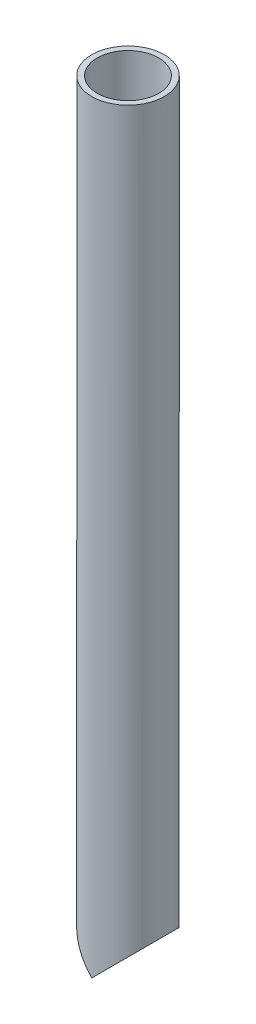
SolidWorks part; units mm, degrees
ref_plane "Front" through (0, 0, 0) normal (0, 0, 1) x (1, 0, 0)
ref_plane "Top" through (0, 0, 0) normal (0, 1, 0) x (1, 0, 0)
ref_plane "Right" through (0, 0, 0) normal (1, 0, 0) x (0, 0, -1)
sketch "Sketch3" plane through (0, 0, 0) normal (0, 1, 0) x (-1, 0, 0)
  circle A0 centre (0, 0) radius 24.13
  circle A1 centre (0, 0) radius 20.447
  dimension "D1" = 48.26
  dimension "D2" = 40.894
extrude "Extrude2" add sketch "Sketch3" along normal blind 508
sketch "Sketch4" plane through (0, 0, -63.5) normal (1, 0, 0) x (0, 0, -1)
  line L0 (-63.5, 508) -> (-63.5, 0) construction
  line L4 (-87.63, 508) -> (-87.63, 0) construction
  circle A0 centre (-63.5, 0) radius 24.13
extrude "Cut-Extrude1" cut sketch "Sketch4" against normal mid plane 76.2
